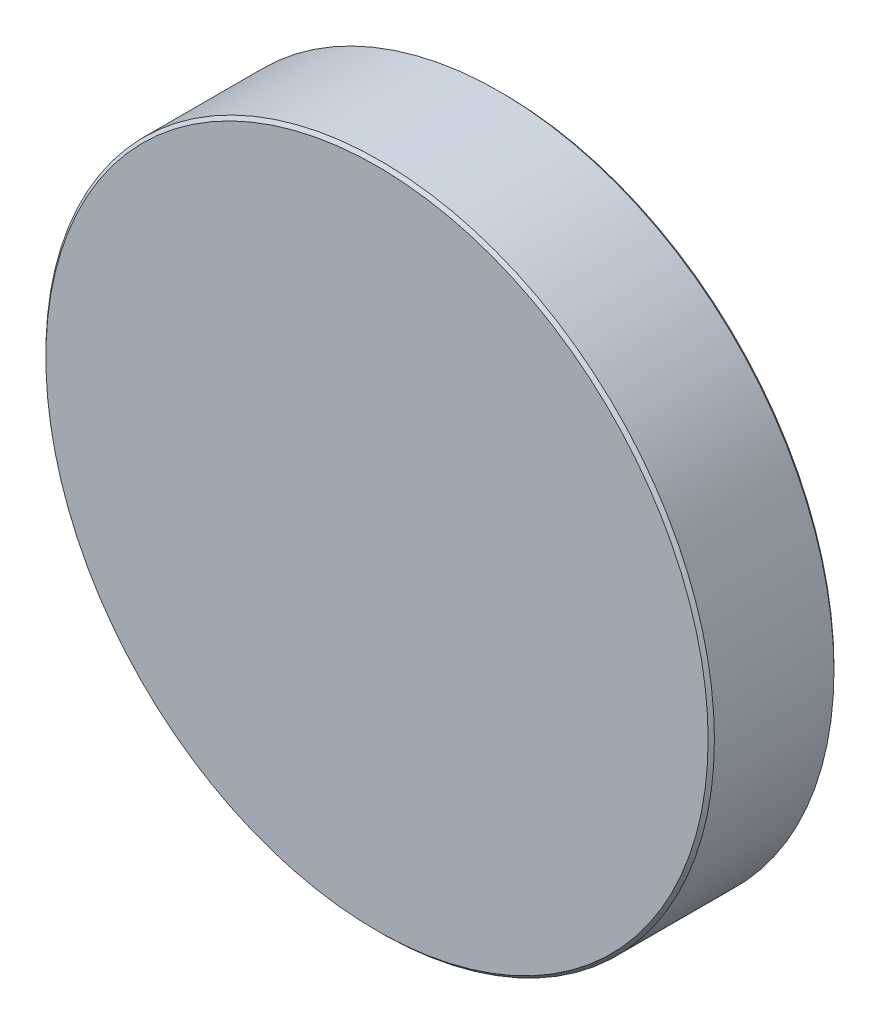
SolidWorks part; units mm, degrees
ref_plane "Front Plane" through (0, 0, 0) normal (0, 0, 1) x (1, 0, 0)
ref_plane "Top Plane" through (0, 0, 0) normal (0, 1, 0) x (1, 0, 0)
ref_plane "Right Plane" through (0, 0, 0) normal (1, 0, 0) x (0, 0, -1)
sketch "Sketch1" plane through (0, 0, 0) normal (0, 0, 1) x (1, 0, 0)
  circle A0 centre (0, 0) radius 26.9875
  dimension "D1" = 53.975
extrude "window" add sketch "Sketch1" along normal blind 10.16
chamfer "Chamfer1" distance 0.254 angle 45 2 edges at (26.9875, 0, 0) (26.9875, 0, 10.16)
